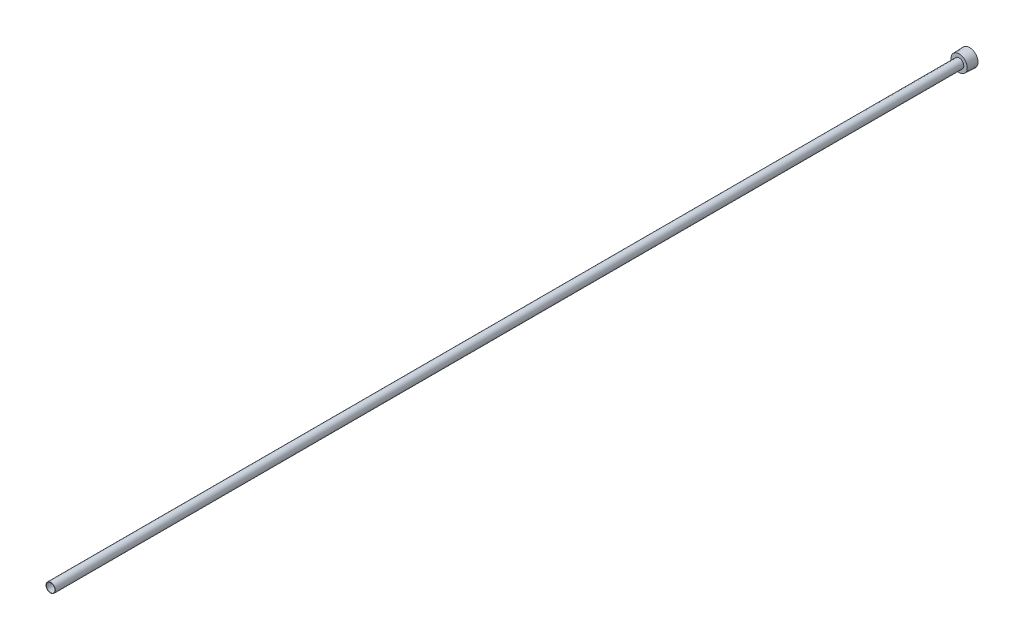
SolidWorks part; units mm, degrees
ref_plane "Front Plane" through (0, 0, 0) normal (0, 0, 1) x (1, 0, 0)
ref_plane "Top Plane" through (0, 0, 0) normal (0, 1, 0) x (1, 0, 0)
ref_plane "Right Plane" through (0, 0, 0) normal (1, 0, 0) x (0, 0, -1)
sketch "Sketch1" plane through (0, 0, 0) normal (1, 0, 0) x (0, 0, -1)
  line L0 (-168.7934, 0) -> (49831.2066, 0) construction
  line L6 (0, 0) -> (0, 8.4709)
  line L7 (0, 8.4709) -> (-10.3124, 8.0947)
  line L8 (-10.3124, 8.0947) -> (-10.3124, 4.6355)
  line L9 (-10.3124, 4.6355) -> (-914.4, 4.6355)
  line L10 (-914.4, 4.6355) -> (-914.4, 0)
  line L11 (0, 0) -> (-914.4, 0)
  dimension "D1" = 10.3124
  dimension "D2" = 16.9418
  dimension "D3" = 2.089
  dimension "D4" = 9.271
  dimension "D5" = 914.4
revolve "Revolve1" add sketch "Sketch1" angle 360 about L0
sketch "Sketch2" plane through (0, 0, 914.4) normal (0, 0, 1) x (1, 0, 0)
  circle A0 centre (0, 0) radius 4.318
  dimension "D1" = 8.636
extrude "Cut-Extrude1" cut sketch "Sketch2" against normal through all
sketch "Sketch3" plane through (0, 0, 0) normal (0, 0, -1) x (-1, 0, 0)
  line L0 (0, 9.318) -> (0, -9.318) construction
  line L1 (4.7625, -2.7496) -> (4.7625, 2.7496)
  line L2 (4.7625, 2.7496) -> (0, 5.4993)
  line L3 (0, 5.4993) -> (-4.7625, 2.7496)
  line L4 (-4.7625, 2.7496) -> (-4.7625, -2.7496)
  line L5 (-4.7625, -2.7496) -> (0, -5.4993)
  line L6 (0, -5.4993) -> (4.7625, -2.7496)
  circle A0 centre (0, 0) radius 4.7625 construction
  dimension "D1" = 9.525
extrude "Cut-Extrude2" cut sketch "Sketch3" against normal blind 6.35
